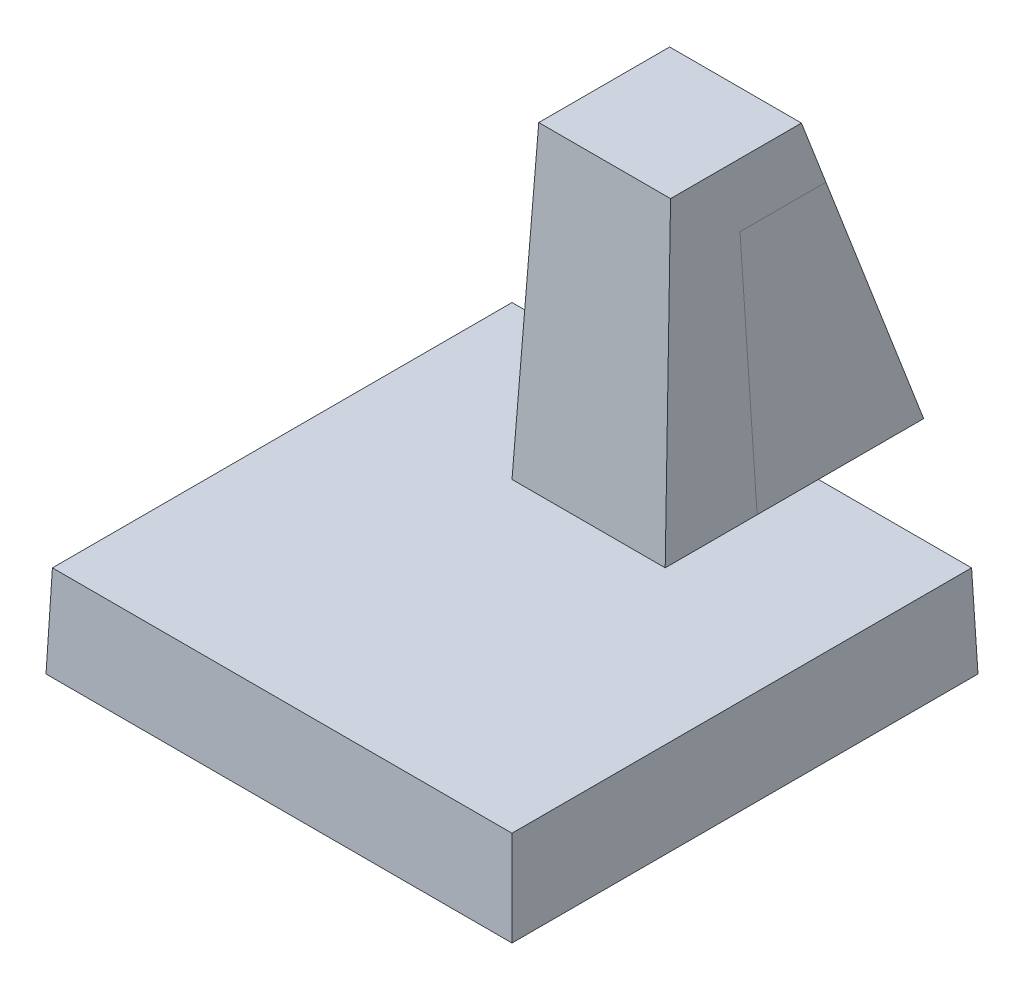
SolidWorks part; units mm, degrees
ref_plane "Front Plane" through (0, 0, 0) normal (0, 0, 1) x (1, 0, 0)
ref_plane "Top Plane" through (0, 0, 0) normal (0, 1, 0) x (1, 0, 0)
ref_plane "Right Plane" through (0, 0, 0) normal (1, 0, 0) x (0, 0, -1)
sketch "Sketch1" plane through (0, 0, 0) normal (1, 0, 0) x (0, 0, -1)
  line L6 (0, 0) -> (0.5241, 10)
  line L7 (0.5241, 10) -> (4.7961, 10)
  line L8 (4.7961, 10) -> (5.5241, 8)
  line L9 (5.5241, 8) -> (2.7206, 8)
  line L10 (2.7206, 8) -> (3, 0)
  line L11 (3, 0) -> (0, 0)
  dimension "D1" = 10
  dimension "D2" = 87
  dimension "D3" = 88
  dimension "D4" = 3
  dimension "D5" = 5
  dimension "D6" = 2
  dimension "D7" = 110
extrude "Boss-Extrude1" add sketch "Sketch1" along normal mid plane 5
sketch "Sketch2" plane through (0, 0, 0) normal (0, 1, 0) x (1, 0, 0)
  line L5 (-7.5, 5) -> (7.5, 5)
  line L6 (-7.5, 5) -> (-7.5, -10)
  line L7 (-7.5, -10) -> (7.5, -10)
  line L8 (7.5, 5) -> (7.5, -10)
  dimension "D1" = 15
  dimension "D2" = 10
  dimension "D3" = 7.5
extrude "Boss-Extrude2" add sketch "Sketch2" against normal blind 3 draft 2
draft "Draft1" type of draft neutral plane draft angle 2 faces to draft 2 parameters "D1"=2
sketch "Sketch3" plane through (0, 0, 0) normal (1, 0, 0) x (0, 0, -1)
  line L0 (2.7206, 8) -> (5.5241, 8) construction
  line L1 (3, 0) -> (2.7206, 8) construction
  line L2 (2.7206, 8) -> (5.5241, 8)
  line L3 (3, 0) -> (2.7206, 8)
  line L4 (3, 0) -> (8.4358, 0)
  line L5 (8.4358, 0) -> (5.5241, 8)
  dimension "D1" = 70
extrude "Boss-Extrude3" add sketch "Sketch3" along normal mid plane 5 separate body contours L5 L2 L3 L4
draft "Draft2" type of draft neutral plane draft angle 2 faces to draft 2 parameters "D1"=2
